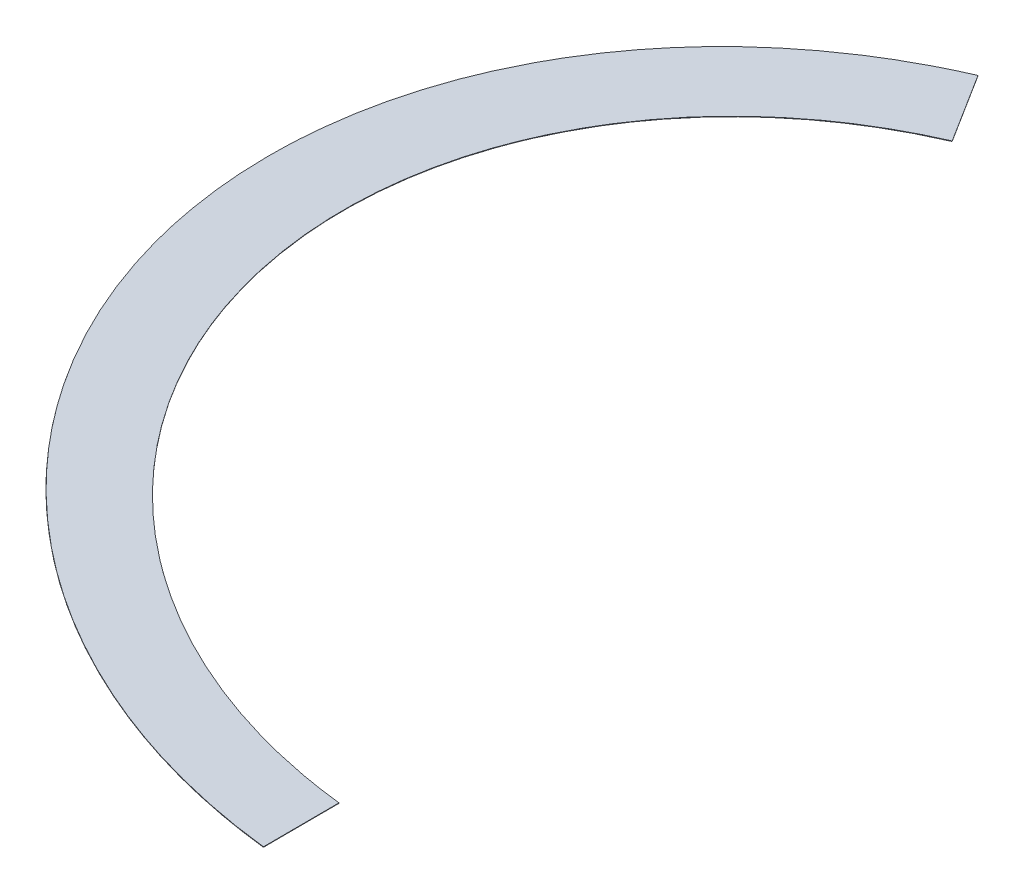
SolidWorks part; units mm, degrees
ref_plane "Ebene vorne" through (0, 0, 0) normal (0, 0, 1) x (1, 0, 0)
ref_plane "Ebene oben" through (0, 0, 0) normal (0, 1, 0) x (1, 0, 0)
ref_plane "Ebene rechts" through (0, 0, 0) normal (1, 0, 0) x (0, 0, -1)
ref_plane "Ebene2" through (0, 0, 0) normal (1, 0, 0) x (0, 0, -1)
sketch "Skizze2" plane through (0, 0, 0) normal (0, 1, 0) x (1, 0, 0)
  circle A0 centre (0, 0) radius 5350
  dimension "D1" = 10700
curve "Spirale/Helix1"
sketch "Skizze3" plane through (0, 0, 5800) normal (1, 0, 0) x (0, 0.9253, 0.3791)
  line L0 (-170.617, -416.4019) -> (167.3495, 417.7316)
  line L1 (-4227.4324, -10317.5247) -> (-170.6139, -416.4023) construction
  line L2 (-170.9162, -417.1403) -> (3630.4883, 8965.0869) construction
  dimension "D1" = 900
surface "Oberfläche-Austragung1"
sketch3d "3D-Skizze2"
  spline S0 degree 2 number of poles 101 (0, -3.5246, 6249.9923) -> (-3124.9962, 1894.392, -5412.6521) construction
  spline S1 degree 2 number of poles 101 (0, -3.5246, 6249.9923) -> (-3124.9962, 1894.392, -5412.6521)
delete or keep bodies "Körper-Löschen1" type delete bodies bodies 102
sketch3d "3D-Skizze3"
  spline S1 degree 3 number of poles 103 (0, 0, 5350) -> (-2675, 1897.9167, -4633.2359)
  spline S2 degree 3 number of poles 103 (0, 0, 5350) -> (-2675, 1897.9167, -4633.2359)
  dimension "D1" = 0
sheet metal parameters "Blech1" thickness 6 parameters "D1"=0.5, "Dicke"=6
lofted bend "Ausgeformte Biegungen1" parameters "D1"=0, "D12"=6
other "Freiform-Biegung1" parameters "D1"=1000, "D4"=57.296, "D5"=1
flat pattern "Abwicklung1"
sketch "Biegung-Linien1" plane through (2.5782, 20.6296, 0.0808) normal (-0.124, -0.9923, -0.0039) x (0.9923, -0.124, -0.0005)
  line L0 (-2.5983, 5349.959) -> (-2.5983, 6249.9582) construction
  line L1 (-128.82, 5348.4263) -> (-153.612, 6248.084) construction
  line L2 (-255.0098, 5343.9685) -> (-304.5812, 6242.6312) construction
  line L3 (-381.0608, 5336.5841) -> (-455.3675, 6233.5675) construction
  line L4 (-506.9076, 5326.285) -> (-605.9048, 6220.9234) construction
  line L5 (-632.4804, 5313.0595) -> (-756.0956, 6204.7111) construction
  line L6 (-757.7134, 5296.9358) -> (-905.8504, 6184.9131) construction
  line L7 (-882.5367, 5277.9091) -> (-1048.3207, 6162.6996) construction
  line L8 (-1006.8838, 5255.9902) -> (-1190.2519, 6137.2526) construction
  line L9 (-1130.6891, 5231.193) -> (-1331.5724, 6108.5858) construction
  line L10 (-1253.8861, 5203.5318) -> (-1472.2072, 6076.7149) construction
  line L11 (-1376.41, 5173.0266) -> (-1612.0801, 6041.6554) construction
  line L12 (-1498.1912, 5139.6801) -> (-1751.1142, 6003.4271) construction
  line L13 (-1619.1689, 5103.527) -> (-1889.242, 5962.0499) construction
  line L14 (-1739.2746, 5064.5719) -> (-2026.3974, 5917.5427) construction
  line L15 (-1858.446, 5022.8412) -> (-2168.9616, 5867.5828) construction
  line L16 (-1976.6181, 4978.3571) -> (-2310.2979, 5814.2448) construction
  line L17 (-2093.7267, 4931.1445) -> (-2450.3186, 5757.5479) construction
  line L18 (-2209.7117, 4881.2349) -> (-2588.9491, 5697.5419) construction
  line L19 (-2324.5035, 4828.6395) -> (-2726.1149, 5634.2637) construction
  line L20 (-2438.0485, 4773.4051) -> (-2861.7293, 5567.7236) construction
  line L21 (-2550.2789, 4715.55) -> (-2989.6762, 5501.2145) construction
  line L22 (-2661.1357, 4655.1065) -> (-3116.0746, 5431.8163) construction
  line L23 (-2770.5606, 4592.1077) -> (-3240.8612, 5359.5644) construction
  line L24 (-2878.4949, 4526.588) -> (-3363.9809, 5284.4905) construction
  line L25 (-2984.8842, 4458.5882) -> (-3485.3529, 5206.6439) construction
  line L26 (-3089.6635, 4388.1328) -> (-3604.9311, 5126.0543) construction
  line L27 (-3192.7855, 4315.2733) -> (-3722.6428, 5042.7705) construction
  line L28 (-3294.187, 4240.0362) -> (-3838.4317, 4956.8321) construction
  line L29 (-3393.8178, 4162.467) -> (-3957.6044, 4864.0039) construction
  line L30 (-3491.623, 4082.6071) -> (-4074.536, 4768.3652) construction
  line L31 (-3587.5499, 4000.5005) -> (-4189.1526, 4669.9591) construction
  line L32 (-3681.5514, 3916.1962) -> (-4301.3942, 4568.8624) construction
  line L33 (-3773.5654, 3829.7273) -> (-4411.213, 4465.1237) construction
  line L34 (-3863.5556, 3741.1551) -> (-4518.5119, 4358.7959) construction
  line L35 (-3951.4639, 3650.5184) -> (-4618.5536, 4254.9438) construction
  line L36 (-4037.2445, 3557.8667) -> (-4716.2075, 4148.8459) construction
  line L37 (-4120.8529, 3463.2502) -> (-4811.4225, 4040.5602) construction
  line L38 (-4202.2444, 3366.72) -> (-4904.1516, 3930.1395) construction
  line L39 (-4281.3801, 3268.3319) -> (-4994.3417, 3817.6323) construction
  line L40 (-4358.2064, 3168.1303) -> (-5081.9636, 3703.1095) construction
  line L41 (-4432.6957, 3066.1793) -> (-5166.9576, 3586.6212) construction
  line L42 (-4504.7961, 2962.5241) -> (-5249.2762, 3468.2266) construction
  line L43 (-4574.4734, 2857.2229) -> (-5332.6063, 3342.2294) construction
  line L44 (-4641.6915, 2750.3341) -> (-5412.9119, 3214.2862) construction
  line L45 (-4706.4141, 2641.9161) -> (-5490.1561, 3084.4687) construction
  line L46 (-4768.604, 2532.0257) -> (-5564.2804, 2952.8375) construction
  line L47 (-4828.2179, 2420.7173) -> (-5635.2588, 2819.4834) construction
  line L48 (-4885.2552, 2308.0671) -> (-5703.0288, 2684.4752) construction
  line L49 (-4939.6488, 2194.119) -> (-5764.7141, 2554.142) construction
  line L50 (-4991.3922, 2078.944) -> (-5823.4162, 2422.441) construction
  line L51 (-5040.4449, 1962.5976) -> (-5879.0969, 2289.4321) construction
  line L52 (-5086.79, 1845.1465) -> (-5931.7626, 2155.1955) construction
  line L53 (-5130.3987, 1726.652) -> (-5981.3585, 2019.7925) construction
  line L54 (-5171.2438, 1607.1768) -> (-6027.8474, 1883.2999) construction
  line L55 (-5209.3149, 1486.7889) -> (-6071.2445, 1745.783) construction
  line L56 (-5244.5802, 1365.5486) -> (-6111.4979, 1607.32) construction
  line L57 (-5277.0243, 1243.5213) -> (-6150.2779, 1461.3222) construction
  line L58 (-5306.6298, 1120.7736) -> (-6185.573, 1314.4355) construction
  line L59 (-5333.3807, 997.3723) -> (-6217.3586, 1166.7588) construction
  line L60 (-5357.2609, 873.3835) -> (-6245.6206, 1018.3584) construction
  line L61 (-5378.2595, 748.8743) -> (-6270.3403, 869.3313) construction
  line L62 (-5396.3638, 623.9124) -> (-6291.505, 719.7634) construction
  line L63 (-5411.5714, 498.5664) -> (-6308.3774, 576.5623) construction
  line L64 (-5423.8606, 372.9017) -> (-6321.9899, 433.0119) construction
  line L65 (-5433.2325, 246.9858) -> (-6332.3449, 289.1854) construction
  line L66 (-5439.6886, 120.8867) -> (-6339.4218, 145.1582) construction
  line L67 (-5443.2152, -5.3283) -> (-6343.2225, 1.0084) construction
  line L68 (-5443.813, -131.5911) -> (-6343.7532, -143.1845) construction
  line L69 (-5441.4829, -257.8339) -> (-6341.0002, -287.3503) construction
  line L70 (-5436.2262, -383.9895) -> (-6334.971, -431.4202) construction
  line L71 (-5428.0426, -509.9907) -> (-6325.1462, -582.165) construction
  line L72 (-5416.9443, -635.7696) -> (-6311.7354, -732.6343) construction
  line L73 (-5402.924, -761.2563) -> (-6294.7463, -882.74) construction
  line L74 (-5385.9998, -886.3843) -> (-6274.1935, -1032.3958) construction
  line L75 (-5366.1799, -1011.0865) -> (-6250.0762, -1181.5162) construction
  line L76 (-5343.4733, -1135.2946) -> (-6222.4168, -1330.0217) construction
  line L77 (-5317.8963, -1258.9421) -> (-6192.7212, -1471.1317) construction
  line L78 (-5289.4501, -1381.9601) -> (-6159.8286, -1611.5266) construction
  line L79 (-5258.1701, -1504.2886) -> (-6123.7567, -1751.1364) construction
  line L80 (-5224.0557, -1625.8569) -> (-6084.5117, -1889.8965) construction
  line L81 (-5187.1315, -1746.6016) -> (-6042.1341, -2027.7203) construction
  line L82 (-5147.4151, -1866.4568) -> (-5996.6245, -2164.5504) construction
  line L83 (-5104.9303, -1985.3589) -> (-5948.0268, -2300.3094) construction
  line L84 (-5059.7001, -2103.2448) -> (-5896.3512, -2434.9278) construction
  line L85 (-5011.7498, -2220.0525) -> (-5838.9524, -2574.6581) construction
  line L86 (-4961.0968, -2335.7147) -> (-5778.239, -2712.9825) construction
  line L87 (-4907.7847, -2450.1757) -> (-5714.2468, -2849.8246) construction
  line L88 (-4851.8232, -2563.3648) -> (-5647.014, -2985.0965) construction
  line L89 (-4793.2555, -2675.2276) -> (-5576.5848, -3118.7438) construction
  line L90 (-4732.1105, -2785.7019) -> (-5502.9954, -3250.6653) construction
  line L91 (-4668.4152, -2894.7236) -> (-5429.834, -3374.9271) construction
  line L92 (-4602.2069, -3002.2365) -> (-5353.8711, -3497.4944) construction
  line L93 (-4533.5389, -3108.1958) -> (-5275.1366, -3618.2938) construction
  line L94 (-4462.4269, -3212.5306) -> (-5193.6895, -3737.2804) construction
  line L95 (-4388.9069, -3315.1827) -> (-5109.5495, -3854.3812) construction
  line L96 (-4313.0339, -3416.1082) -> (-5022.7601, -3969.536) construction
  line L97 (-4234.8335, -3515.2412) -> (-4933.3989, -4082.7087) construction
  line L98 (-4154.3584, -3612.5377) -> (-4841.4724, -4193.8085) construction
  line L99 (-4071.6474, -3707.9429) -> (-4742.4909, -4307.9221) construction
  line L100 (-3986.7431, -3801.4027) -> (-4640.8244, -4419.6468) construction
  line L101 (-3899.6991, -3892.873) -> (-4536.5271, -4528.9234) construction
  line L102 (-3810.5515, -3982.2942) -> (-4429.6498, -4635.687) construction
  line L103 (-3719.3595, -4069.6298) -> (-4320.2595, -4739.8743) construction
  line L104 (-3626.1623, -4154.8209) -> (-4208.4204, -4841.4225) construction
  line L105 (-3531.0209, -4237.833) -> (-4099.4498, -4935.8537) construction
  line L106 (-3433.9751, -4318.609) -> (-3988.3551, -5027.7722) construction
  line L107 (-3335.0847, -4397.116) -> (-3875.2023, -5117.1491) construction
  line L108 (-3234.4005, -4473.3087) -> (-3760.0413, -5203.9309) construction
  line L109 (-3131.9731, -4547.1412) -> (-3642.9364, -5288.0747) construction
  line L110 (-3027.8677, -4618.5882) -> (-3523.9589, -5369.5354) construction
  line L111 (-2922.1267, -4687.5937) -> (-3403.1462, -5448.2661) construction
  line L112 (-2814.8486, -4754.1163) -> (-3280.6171, -5524.2191) construction
other "Abwickeln-<Freiform-Biegung1>1"
